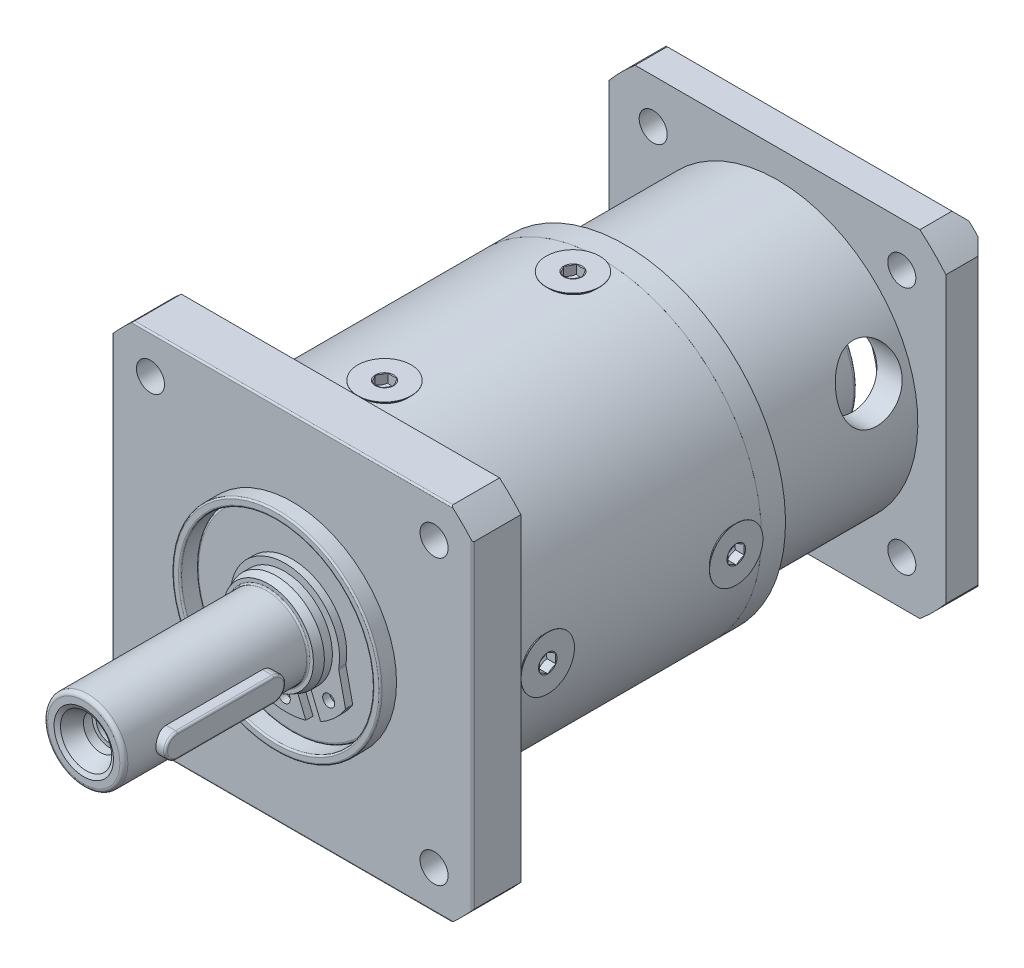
SolidWorks part; units mm, degrees
other "Éî¹µÇòÖá³Ð60000ÐÍ18ÏµÁÐ-1-solid1"
other "ÇÐ³ý-À Éì1[6]"
other "ÇÐ³ý-À Éì1[8]"
other "ÇÐ³ý-À Éì1[9]"
other "³ÁÍ·ÂÝ¶¤M3¡Á6-5-solid1"
other "ÇÐ³ý-À Éì1[11]"
other "ÖáÓÃµ¯ÐÔµ²È¦AÐÍ£¨¡Ý10£©-1-solid1"
other "PL40.030.L1-1-solid1"
other "ÇÐ³ý-À Éì1[10]"
other "³ÁÍ·ÂÝ¶¤M3¡Á6-2-solid1"
other "ÇÐ³ý-À Éì1[7]"
other "ÆÕÍ¨Æ½¼üAÐÍ A3-1-solid1"
other "Éî¹µÇòÖá³Ð60000ÐÍ18ÏµÁÐ-1-solid4"
other "³ÁÍ·ÂÝ¶¤M3¡Á6-4-solid1"
other "12.9-ÄÚÁù½ÇÔ²ÖùÍ·ÂÝ¶¤-M4-1-solid1"
other "Éî¹µÇòÖá³Ð60000ÐÍ19ÏµÁÐ-1-solid1"
other "Éî¹µÇòÖá³Ð60000ÐÍ18ÏµÁÐ-1-solid3"
other "ÇÐ³ý-À Éì1[3]"
other "Éî¹µÇòÖá³Ð60000ÐÍ18ÏµÁÐ-1-solid5"
other "ÇÐ³ý-À Éì1[4]"
other "ÇÐ³ý-À Éì1[5]"
other "³ÁÍ·ÂÝ¶¤M3¡Á6-3-solid1"
other "ÇÐ³ý-À Éì1[2]"
other "Éî¹µÇòÖá³Ð60000ÐÍ18ÏµÁÐ-1-solid2"
other "ÇÐ³ý-À Éì1[1]"
other "µ¯µæ-1-solid1"
ref_plane "Front Plane" through (0, 0, 0) normal (0, 0, 1) x (1, 0, 0)
ref_plane "Top Plane" through (0, 0, 0) normal (0, 1, 0) x (1, 0, 0)
ref_plane "Right Plane" through (0, 0, 0) normal (1, 0, 0) x (0, 0, -1)
imported_body "Imported1"
imported_body "Imported2"
imported_body "Imported3"
imported_body "Imported4"
imported_body "Imported5"
imported_body "Imported6"
imported_body "Imported7"
imported_body "Imported8"
imported_body "Imported9"
imported_body "Imported10"
imported_body "Imported11"
imported_body "Imported12"
imported_body "Imported13"
imported_body "Imported14"
imported_body "Imported15"
imported_body "Imported16"
imported_body "Imported17"
imported_body "Imported18"
imported_body "Imported19"
imported_body "Imported20"
imported_body "Imported21"
imported_body "Imported22"
imported_body "Imported23"
imported_body "Imported24"
imported_body "Imported25"
imported_body "Imported26"
move or copy body "Body-Move/Copy1" bodies to move or copy 118 126 copy no rotation origin (-4.8099, 13.8621, 0) rotation axis (0, 0, -1) rotation angle 2.766
sketch "Sketch1" plane through (0, 0, 46.25) normal (0, 0, 1) x (1, 0, 0)
  circle A0 centre (-4.8099, 13.8621) radius 10.3
  circle A1 centre (-4.8099, 13.8621) radius 10.3 construction
  circle A2 centre (-4.8099, 13.8621) radius 7.75
  circle A3 centre (-4.8099, 13.8621) radius 7.75 construction
extrude "Boss-Extrude1" add sketch "Sketch1" against normal blind 0.5
ref_plane "Plane1" through (-4.8099, 0, 0) normal (1, 0, 0) x (0, 0, -1)
ref_plane "Plane2" through (0, 13.8621, 0) normal (0, 1, 0) x (1, 0, 0)
